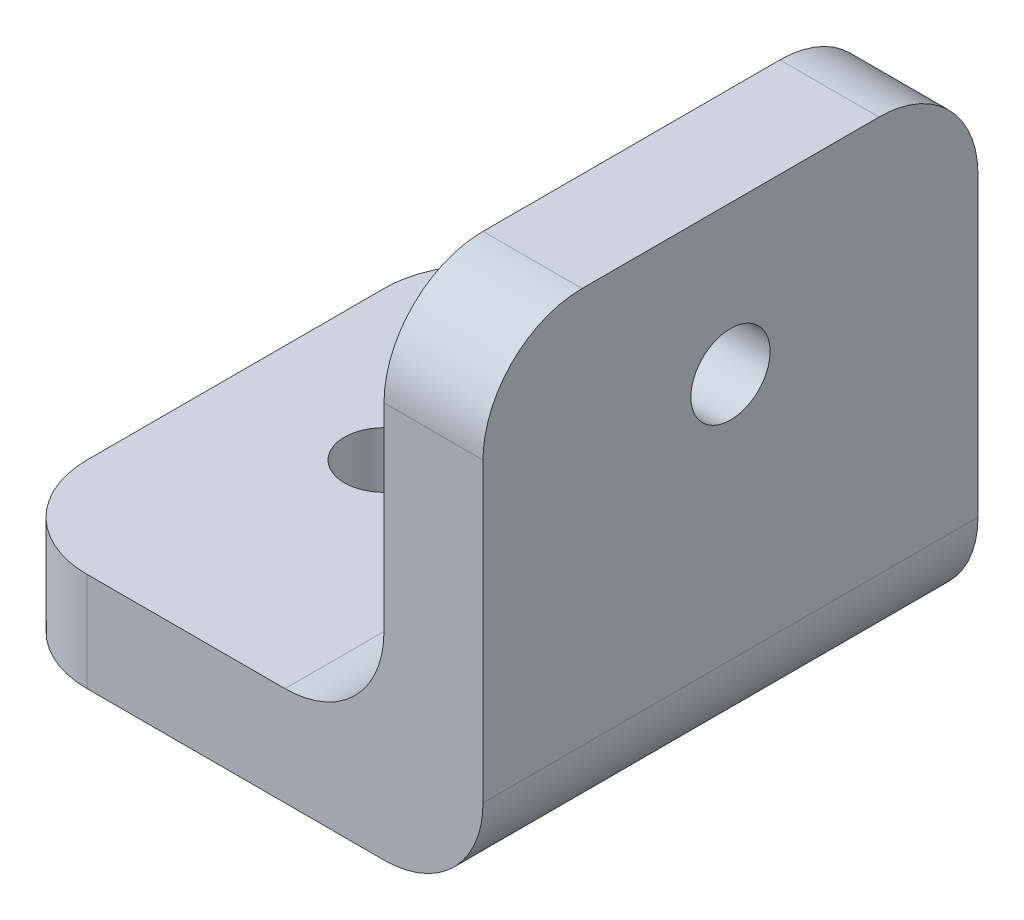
SolidWorks part; units mm, degrees
ref_plane "Front Plane" through (0, 0, 0) normal (0, 0, 1) x (1, 0, 0)
ref_plane "Top Plane" through (0, 0, 0) normal (0, 1, 0) x (1, 0, 0)
ref_plane "Right Plane" through (0, 0, 0) normal (1, 0, 0) x (0, 0, -1)
sketch "Sketch1" plane through (0, 0, 0) normal (0, 0, 1) x (1, 0, 0)
  line L1 (0, 0) -> (50, 0)
  line L2 (0, 0) -> (0, 10)
  line L3 (0, 10) -> (40, 10)
  line L4 (50, 0) -> (50, 50)
  line L7 (50, 50) -> (40, 50)
  line L8 (40, 10) -> (40, 50)
  dimension "D1" = 50
  dimension "D2" = 50
  dimension "D3" = 40
  dimension "D4" = 40
extrude "Boss-Extrude1" add sketch "Sketch1" along normal blind 50
fillet "Fillet1" radius 10 6 edges at (0, 5, 0) (0, 5, 50) (45, 50, 0) (45, 50, 50) (50, 0, 25) (40, 10, 25)
sketch "Sketch2" plane through (40, 0, 0) normal (-1, 0, 0) x (0, 0, 1)
  line L0 (25, 50) -> (25, 27.566) construction
  line L1 (40, 50) -> (10, 50) construction
  circle A0 centre (25, 35) radius 4
  dimension "D1" = 8
  dimension "D2" = 15
extrude "Cut-Extrude1" cut sketch "Sketch2" against normal blind 50
sketch "Sketch3" plane through (0, 10, 0) normal (0, 1, 0) x (1, 0, 0)
  line L0 (0, -25) -> (23.7375, -25) construction
  line L1 (0, -40) -> (0, -10) construction
  circle A0 centre (15, -25) radius 4
  dimension "D1" = 8
  dimension "D2" = 15
extrude "Cut-Extrude2" cut sketch "Sketch3" against normal blind 50
